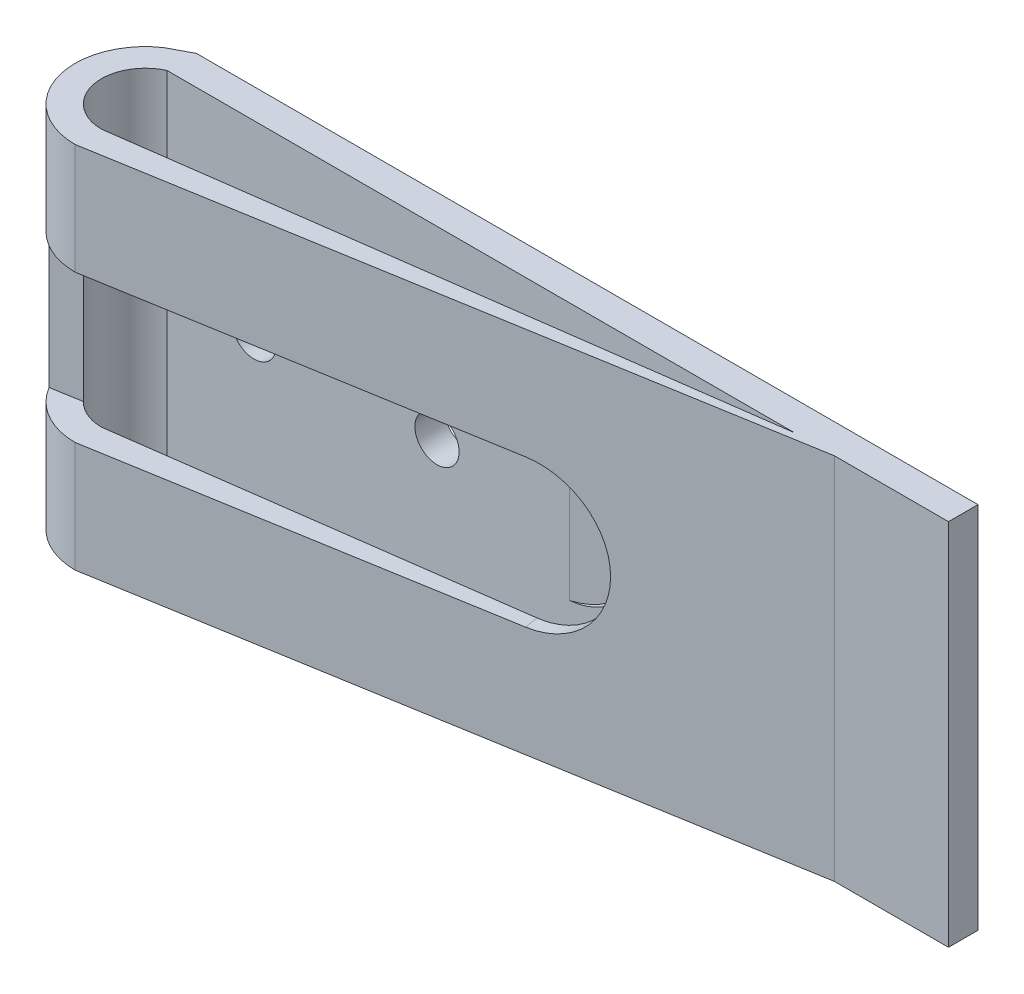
SolidWorks part; units mm, degrees
ref_plane "Plan de face" through (0, 0, 0) normal (0, 0, 1) x (1, 0, 0)
ref_plane "Plan de dessus" through (0, 0, 0) normal (0, 1, 0) x (1, 0, 0)
ref_plane "Plan de droite" through (0, 0, 0) normal (1, 0, 0) x (0, 0, -1)
sketch "Esquisse1" plane through (0, 0, 0) normal (0, 0, 1) x (1, 0, 0)
  line L0 (0, 0) -> (-26.5, 0) construction
  line L1 (-26.5, 12.5) -> (26.5, 12.5)
  line L2 (-26.5, 12.5) -> (-26.5, -12.5)
  line L3 (-26.5, -12.5) -> (26.5, -12.5)
  line L4 (26.5, 12.5) -> (26.5, -12.5)
  circle A0 centre (-20.5984, 0) radius 1.5
  circle A1 centre (-8.1882, 0) radius 1.5
  point P11 (0, 0)
  dimension "D5" = 3
  dimension "D6" = 3
  dimension "D8" = 8.1882
  dimension "D9" = 20.5984
  dimension "D1" = 53
  dimension "D2" = 25
  dimension "D3" = 12.5
  dimension "D4" = 26.5
  dimension "D7" = 90
extrude "Boss.-Extru.1" add sketch "Esquisse1" along normal blind 2
ref_plane "Plan1" through (0, -12.5, 0) normal (0, -1, 0) x (-1, 0, 0)
sketch "Esquisse2" plane through (0, -12.5, 0) normal (0, -1, 0) x (-1, 0, 0)
  line L0 (25.2701, -7.6712) -> (-16.07, -2)
  line L2 (26.5, -2) -> (-26.5, -2) construction
  line L3 (25.2701, -9.4635) -> (-18.7567, -2)
  line L4 (-16.07, -2) -> (-18.7567, -2)
  line L6 (26.5, 0) -> (27.9488, -0.766)
  line L7 (26.5, -2) -> (26.5, 0)
  arc A0 (25.2701, -9.4635) -> (27.9488, -0.766) centre (25.2701, -4.7022) ccw
  arc A1 (25.2701, -7.6712) -> (26.5, -2) centre (25.2701, -4.7022) ccw
extrude "Boss.-Extru.2" add sketch "Esquisse2" against normal blind 25
ref_plane "Plan2" through (0.8535, 0, 5.035) normal (0.1671, 0, 0.9859) x (0.9859, 0, -0.1671)
sketch "Esquisse3" plane through (0.8535, 0, 5.035) normal (0.1671, 0, 0.9859) x (0.9859, 0, -0.1671)
  line L0 (0, 5) -> (-30.4618, 5)
  line L1 (-30.4618, 12.5) -> (-30.4618, -12.5) construction
  line L2 (0, -5) -> (-30.4618, -5)
  line L3 (-30.4618, 5) -> (-30.4618, -5)
  arc A0 (0, -5) -> (0, 5) centre (0, 0) ccw
  dimension "D1" = 7.5
extrude "Enlèv. mat.-Extru.1" cut sketch "Esquisse3" against normal blind 3
